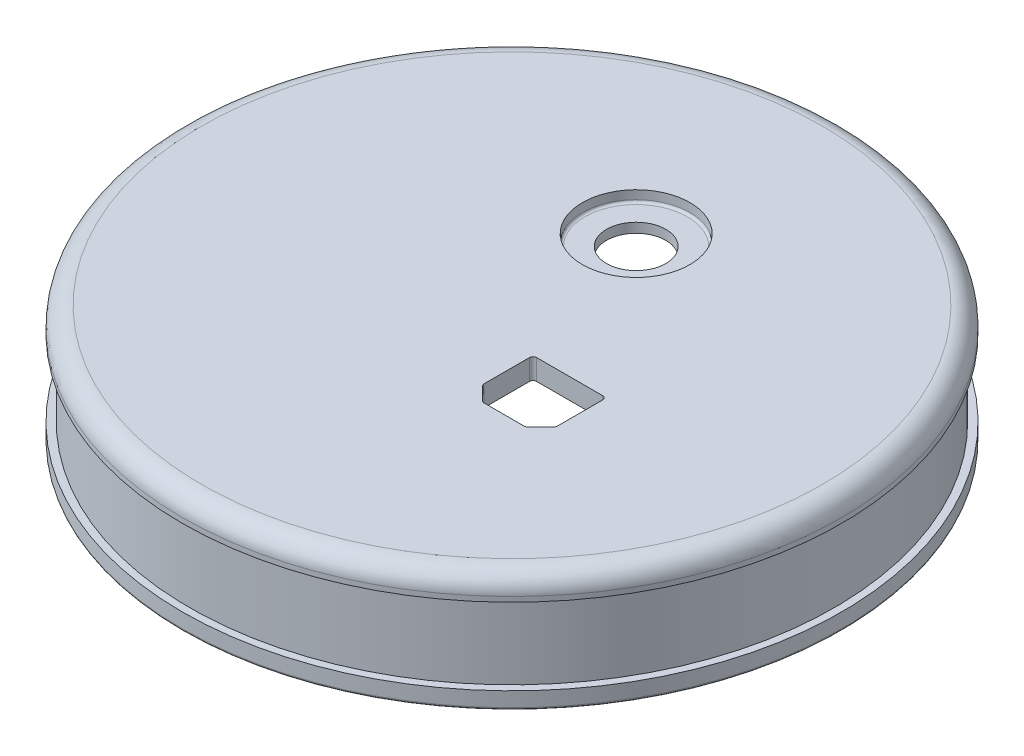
SolidWorks part; units mm, degrees
ref_plane "Front" through (0, 0, 0) normal (0, 0, 1) x (1, 0, 0)
ref_plane "Top" through (0, 0, 0) normal (0, 1, 0) x (1, 0, 0)
ref_plane "Right" through (0, 0, 0) normal (1, 0, 0) x (0, 0, -1)
sketch "Sketch1" plane through (0, 0, 0) normal (0, 0, 1) x (1, 0, 0)
  line L0 (0, -16.1907) -> (0, 12.6391) construction
  line L1 (31.61, -10.1387) -> (31.61, 0)
  line L2 (31.61, 0) -> (0, 0)
  line L3 (0, 0) -> (0, 2.159)
  line L4 (31.61, -10.1387) -> (34.372, -10.1387)
  line L5 (34.372, -10.1387) -> (34.372, -8.3607)
  line L6 (34.372, -8.3607) -> (33.61, -8.3607)
  line L7 (33.61, -8.3607) -> (33.61, -0.3607)
  line L8 (33.61, -0.3607) -> (34.372, -0.3607)
  line L9 (34.372, -0.3607) -> (34.372, 0.159)
  line L10 (32.372, 2.159) -> (0, 2.159)
  arc A2 (34.372, 0.159) -> (32.372, 2.159) centre (32.372, 0.159) ccw
  dimension "D4" = 2.159
  dimension "D5" = 8
  dimension "D6" = 2
  dimension "D1" = 63.22
  dimension "D2" = 2
  dimension "D3" = 0.762
  dimension "D8" = 1.778
revolve "Revolve1" add sketch "Sketch1" angle 360 about L0
sketch "Sketch2" plane through (0, 0, 0) normal (0, -1, 0) x (1, 0, 0)
  circle A0 centre (0, 24.15) radius 3.1115
  circle A1 centre (0, 24.15) radius 2.8 construction
  dimension "D1" = 6.223
extrude "Cut-Extrude1" cut sketch "Sketch2" against normal blind 0.762
mirror "Mirror1" about plane through (0, 0, 0) normal (0, 0, 1) of "Cut-Extrude1"
sketch "Sketch3" plane through (0, 0, 0) normal (0, 0, 1) x (1, 0, 0)
  line L0 (0, 0) -> (0, -19.6587) construction
  line L1 (31.61, -10.1387) -> (31.61, 0) construction
  line L2 (31.61, -3.9797) -> (31.61, -4.7417)
  line L3 (31.61, -0.3607) -> (31.61, -8.3607) construction
  line L4 (-33.61, -0.3607) -> (33.61, -0.3607) construction
  line L5 (33.61, -8.3607) -> (-33.61, -8.3607) construction
  arc A0 (31.61, -3.9797) -> (31.61, -4.7417) centre (31.61, -4.3607) ccw
  point P15 (31.61, -4.3607)
  dimension "D1" = 0.762
revolve "Revolve2" add sketch "Sketch3" angle 360 about L0
sketch "Sketch4" plane through (0, 2.159, 0) normal (0, 1, 0) x (-1, 0, 0)
  circle A0 centre (0, -12.9492) radius 5.608
  circle A2 centre (0, -12.9492) radius 5.1 construction
  dimension "D1" = 0.508
extrude "Cut-Extrude2" cut sketch "Sketch4" against normal up to surface (1.159 mm away)
sketch "Sketch5" plane through (0, 1, 0) normal (0, 1, 0) x (-1, 0, 0)
  circle A0 centre (0, -12.9492) radius 3.0922
  circle A1 centre (0, -12.9492) radius 5.608 construction
  circle A2 centre (0, -12.9492) radius 3.27 construction
  dimension "D1" = 0.1778
extrude "Cut-Extrude3" cut sketch "Sketch5" against normal through all
sketch "Sketch6" plane through (0, 2.159, 0) normal (0, 1, 0) x (-1, 0, 0)
  line L0 (-7.2162, 10.2808) -> (-5.6352, 8.6998)
  line L1 (-5.6352, 3.4372) -> (-13.2788, 3.4372)
  line L2 (-5.6352, 3.4372) -> (-5.6352, 8.6998)
  line L3 (-7.2162, 10.2808) -> (-11.6978, 10.2808)
  line L4 (-13.2788, 3.4372) -> (-13.2788, 8.6998)
  line L5 (-11.6978, 10.2808) -> (-13.2788, 8.6998)
  line L6 (-5.432, 8.784) -> (-7.132, 10.484) construction
  line L7 (-11.782, 10.484) -> (-13.482, 8.784) construction
  line L9 (-5.432, 3.234) -> (-5.432, 8.784) construction
  line L10 (-13.482, 3.234) -> (-5.432, 3.234) construction
  line L11 (-13.482, 8.784) -> (-13.482, 3.234) construction
  line L12 (-7.132, 10.484) -> (-11.782, 10.484) construction
  dimension "D1" = 0.2032
  dimension "D2" = 0.2032
  dimension "D3" = 0.2032
  dimension "D4" = 0.2032
  dimension "D5" = 0.2032
  dimension "D6" = 0.2032
extrude "Cut-Extrude4" cut sketch "Sketch6" against normal through all
sketch "Sketch7" plane through (0, 0, 0) normal (0, -1, 0) x (1, 0, 0)
  circle A0 centre (0, 0) radius 31.61
  circle A1 centre (0, 0) radius 28.321
  circle A2 centre (0, 0) radius 31.61 construction
  dimension "D1" = 56.642
extrude "Extrude1" add sketch "Sketch7" along normal up to surface (1.7 mm away)
fillet "Fillet1" radius 0.381 6 edges at (13.2788, 1.0795, 8.6998) (11.6978, 1.0795, 10.2808) (7.2162, 1.0795, 10.2808) (5.6352, 1.0795, 8.6998) (5.6352, 1.0795, 3.4372) (13.2788, 1.0795, 3.4372)
fillet "Fillet2" radius 0.508 1 edges at (0, 0, -28.321)
chamfer "Chamfer1" distance 0.508 angle 45 1 edges at (0, -10.1387, -31.61)
fillet "Fillet3" radius 0.254 2 edges at (0, 1, -7.3412) (0, -10.1387, -34.372)
fillet "Fillet4" radius 0.508 2 edges at (0, 0.762, -21.0385) (0, 0.762, 21.0385)
